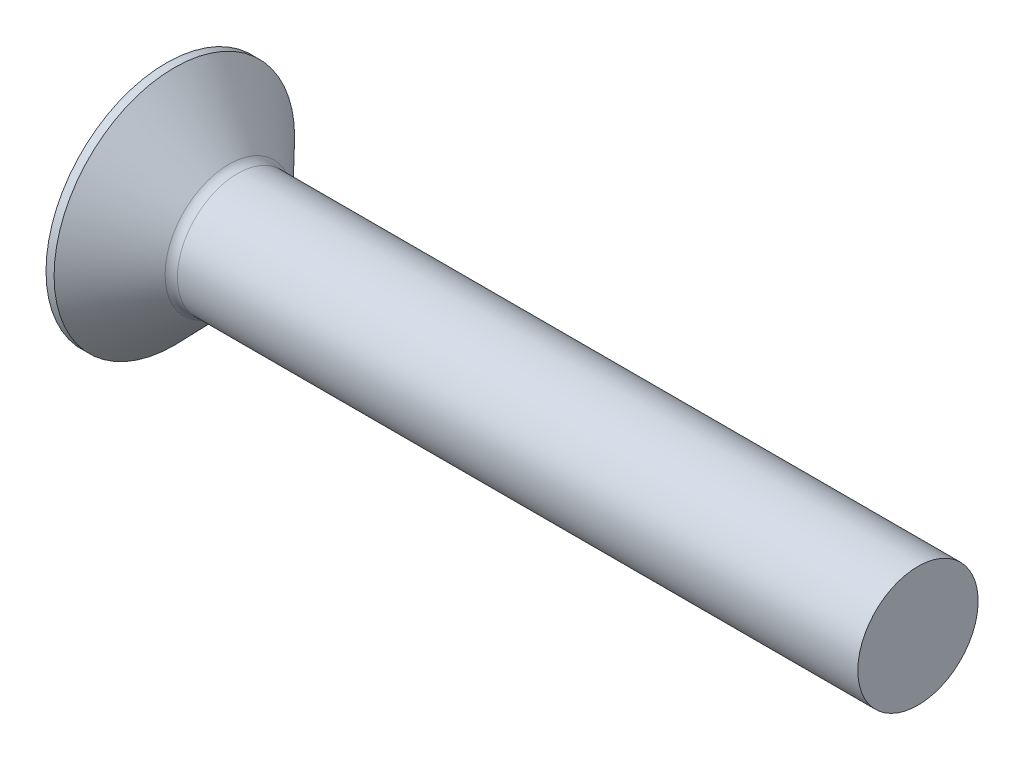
SolidWorks part; units mm, degrees
ref_plane "Front Plane" through (0, 0, 0) normal (0, 0, 1) x (1, 0, 0)
ref_plane "Top Plane" through (0, 0, 0) normal (0, 1, 0) x (1, 0, 0)
ref_plane "Right Plane" through (0, 0, 0) normal (1, 0, 0) x (0, 0, -1)
other "Configuration Table"
sketch "BodySke" plane through (0, 0, 0) normal (0, 0, 1) x (1, 0, 0)
  line L0 (1.8, 0) -> (111.3824, 0) construction
  line L1 (1.8, 0) -> (1.8, 8) construction
  line L2 (1.8, 8) -> (2.3372, 8)
  line L3 (2.3372, 8) -> (6.2, 4)
  line L4 (6.2, 4) -> (51.8, 4)
  line L5 (51.8, 4) -> (51.8, 0)
  line L6 (7.45, 1.8551) -> (7.45, -12.8628) construction
  line L7 (1.8, 0) -> (51.8, 0)
  line L8 (21.8, 2.8551) -> (21.8, -10.9269) construction
  line L9 (1.8, -8) -> (2.3372, -8) construction
  line L10 (2.3372, -8) -> (6.2, -4) construction
  line L11 (6.2, -4) -> (51.8, -4) construction
  line L12 (1.8, 0) -> (-7.747, 0) construction
  line L13 (0, 0) -> (0, 16.1338) construction
  line L14 (1.8, 0) -> (0, 0)
  arc A0 (0, 0) -> (1.8, 8) centre (18.6778, 0) cw
  point P10 (51.8, 3.4455)
revolve "BaseBody" add sketch "BodySke" angle 360 about L0
fillet "Fillet1" radius 0.8 1 edges at (6.2, 0, 4)
ref_plane "Plane1" through (5.18, 0, 0) normal (1, 0, 0) x (0, 0, -1)
sketch "RecSkeTop" plane through (0, 0, 0) normal (1, 0, 0) x (0, 0, -1)
  line L1 (-0.946, 4.3) -> (0.946, 4.3)
  line L2 (-0.946, 4.3) -> (-0.946, -4.3)
  line L3 (-0.946, -4.3) -> (0.946, -4.3)
  line L4 (0.946, 4.3) -> (0.946, -4.3)
sketch "RecSkeBot" plane through (5.18, 0, 0) normal (1, 0, 0) x (0, 0, -1)
  line L0 (-0.946, 4.3) -> (-0.946, -4.3) construction
  line L1 (-0.946, 1.7173) -> (0.946, 1.7173)
  line L2 (-0.946, 1.7173) -> (-0.946, -1.7173)
  line L3 (-0.946, -1.7173) -> (0.946, -1.7173)
  line L4 (0.946, 1.7173) -> (0.946, -1.7173)
  line L5 (0.946, 4.3) -> (0.946, -4.3) construction
loft "Recess" cut profiles "RecSkeTop", "RecSkeBot"
pattern_circular "RecPat" count 2 every 90 about axis through (0, 0, 0) along (1, 0, 0) of "Recess"
sketch "RecCorSke" plane through (0, 0, 0) normal (0, 0, 1) x (1, 0, 0)
  line L0 (0, 0) -> (57.5987, 0) construction
  line L1 (0, 0) -> (0, 2.0812)
  line L3 (0, 2.0812) -> (5.18, 1.719)
  line L4 (5.18, 1.719) -> (5.7385, 0)
  line L5 (5.7385, 0) -> (0, 0)
revolve "RecessCore" cut sketch "RecCorSke" angle 360 about L0
sketch "ThdSchSke" plane through (0, 0, 0) normal (0, 0, 1) x (1, 0, 0)
  line L0 (0, 0) -> (55.1256, 0) construction
  line L1 (1.8, 0) -> (111.3824, 0) construction
  line L2 (51.4799, 4) -> (51.4799, 4.6403)
  line L3 (51.4799, 4.6403) -> (52.1201, 4.6403)
  line L4 (52.1201, 4.6403) -> (52.1201, 4)
  line L5 (52.1201, 4) -> (51.8, 3.4455)
  line L6 (51.8, 3.4455) -> (51.4799, 4)
  line L7 (6.2, 4) -> (51.8, 4) construction
  line L13 (51.8, 4) -> (51.8, 0) construction
revolve "ThreadSchematic" [suppressed] cut sketch "ThdSchSke" angle 360 about L0
pattern_linear "ThdSchPat" [suppressed] count 24 along (1, 0, 0)
equation "\"Thread_minor@ThreadCosmetic\" = \"Thread_minor@BodySke\""
equation "\"D1@RecSkeTop\" = \"Cross_dia@RecSkeTop\" / 2"
equation "\"D2@RecSkeTop\" = \"Cross_dia@RecSkeTop\" * 0.22"
equation "\"D3@RecSkeTop\" = \"D2@RecSkeTop\" / 2"
equation "\"D1@RecSkeBot\" = \"Cross_dia@RecSkeTop\" - 2 * \"Cross_depth@Plane1\" *  tan( 26.5 * 0.017453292 ) "
equation "\"D2@RecSkeBot\" = \"D1@RecSkeBot\" / 2"
equation "\"D2@RecCorSke\" = \"Cross_depth@Plane1\""
equation "\"D3@RecCorSke\" = \"D2@RecSkeTop\" * 1.1"
equation "\"Advance@ThdSchPat\" = \"Advance@BodySke\""
equation "\"D1@ThdSchPat\" =  int( \"Thread_length@BodySke\" / \"Advance@ThdSchPat\" ) "
